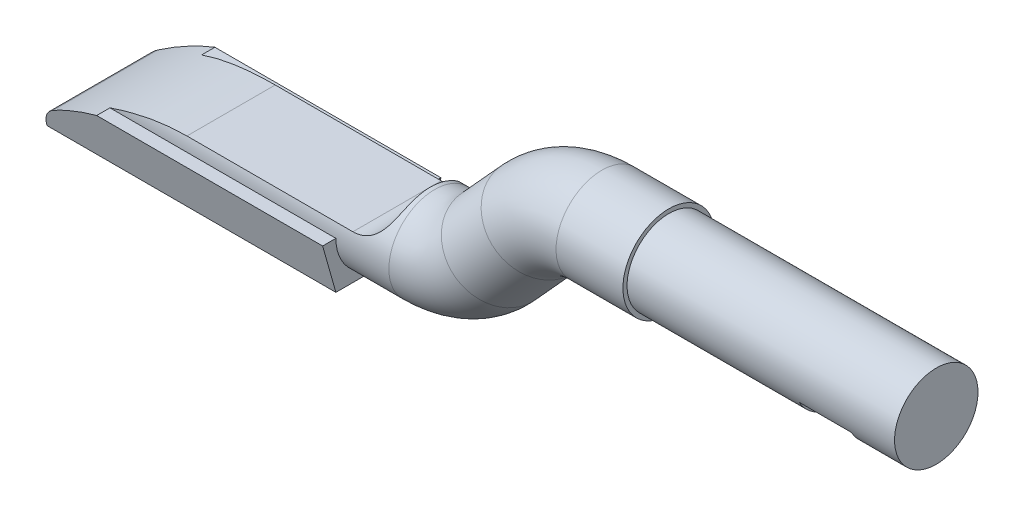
SolidWorks part; units mm, degrees
ref_plane "Front Plane" through (0, 0, 0) normal (0, 0, 1) x (1, 0, 0)
ref_plane "Top Plane" through (0, 0, 0) normal (0, 1, 0) x (1, 0, 0)
ref_plane "Right Plane" through (0, 0, 0) normal (1, 0, 0) x (0, 0, -1)
sketch "Sketch2" plane through (0, 0, 0) normal (0, 0, 1) x (1, 0, 0)
  line L0 (0, 13.9321) -> (0, -13.6478) construction
  line L1 (0, 0) -> (-80.0862, 0) construction
  line L2 (0, 0) -> (-31.75, 0)
  line L3 (-37.7989, -2.6801) -> (-41.5761, -6.8449)
  line L4 (-47.625, -9.525) -> (-80.0862, -9.525)
  arc A0 (-41.5761, -6.8449) -> (-47.625, -9.525) centre (-47.625, -1.3589) cw
  arc A1 (-31.75, 0) -> (-37.7989, -2.6801) centre (-31.75, -8.1661) ccw
  point P12 (-35.3682, 0)
  point P13 (-80.0862, 0)
  point P14 (0, 0)
  point P15 (0, 0)
  point P16 (0, 0)
  point P17 (-44.6575, -1.3589)
  point P18 (0, 0)
  dimension "D4" = 8.1661
  dimension "D1" = 9.525
  dimension "D2" = 31.75
  dimension "D3" = 47.625
  dimension "D5" = 80.0862
sketch "Sketch3" plane through (0, 0, 0) normal (1, 0, 0) x (0, 0, -1)
  circle A0 centre (0, 0) radius 4.3561
  dimension "D1" = 8.7122
sweep "Sweep1" add profiles "Sketch3" path "Sketch2"
sketch "Sketch4" plane through (0, 0, 0) normal (1, 0, 0) x (0, 0, -1)
  circle A0 centre (0, 0) radius 3.9624
  circle A1 centre (0, 0) radius 4.7625
  dimension "D1" = 7.9248
  dimension "D2" = 9.525
extrude "Cut-Extrude1" cut sketch "Sketch4" against normal blind 25.4
sketch "Sketch5" plane through (0, 0, 0) normal (0, 0, 1) x (1, 0, 0)
  line L0 (0, -3.9624) -> (0, 3.9624) construction
  line L1 (-9.525, -5.6896) -> (-4.572, -5.6896)
  line L2 (-9.525, -5.6896) -> (-9.525, -1.8796)
  line L3 (-9.525, -1.8796) -> (-4.572, -1.8796)
  line L4 (-4.572, -5.6896) -> (-4.572, -1.8796)
  line L5 (-9.525, -5.6896) -> (-4.572, -1.8796) construction
  line L6 (-9.525, -1.8796) -> (-4.572, -5.6896) construction
  line L7 (0, 3.9624) -> (-25.4, 3.9624) construction
  point P0 (-7.0485, -3.7846)
  dimension "D1" = 4.953
  dimension "D2" = 9.525
  dimension "D3" = 5.842
  dimension "D4" = 3.81
extrude "Cut-Extrude2" cut sketch "Sketch5" against normal through all both and the other way through all
sketch "Sketch6" plane through (-80.0862, 0, 0) normal (-1, 0, 0) x (0, 0, 1)
  line L0 (0, 0) -> (0, -13.8811) construction
  line L1 (4.3561, -13.97) -> (-4.3561, -13.97)
  line L2 (-4.3561, -13.97) -> (-5.6134, -9.525)
  line L3 (-5.6134, -9.525) -> (5.6134, -9.525)
  line L4 (4.3561, -13.97) -> (5.6134, -9.525)
  circle A0 centre (0, -9.525) radius 4.3561 construction
  point P11 (0, -13.97)
  point P12 (0, -9.525)
  dimension "D1" = 13.97
  dimension "D2" = 8.7122
  dimension "D3" = 11.2268
  dimension "D4" = 9.525
extrude "Boss-Extrude1" add sketch "Sketch6" against normal blind 27.432
sketch "Sketch7" plane through (0, 0, 0) normal (0, 0, 1) x (1, 0, 0)
  line L1 (-80.0862, -3.2639) -> (-48.0314, -3.2639)
  line L2 (-80.0862, -3.2639) -> (-80.0862, -8.3439)
  line L3 (-80.0862, -8.3439) -> (-51.2064, -8.3439)
  line L4 (-48.0314, -3.2639) -> (-48.0314, -5.1689)
  line L5 (-80.0862, -5.1689) -> (-80.0862, -9.525) construction
  line L6 (0, 0) -> (-80.0862, 0) construction
  line L7 (-47.625, -5.1689) -> (-80.0862, -5.1689) construction
  arc A0 (-51.2064, -8.3439) -> (-48.0314, -5.1689) centre (-51.2064, -5.1689) ccw
  point P10 (0, 0)
  dimension "D3" = 3.175
  dimension "D1" = 32.0548
  dimension "D2" = 3.175
  dimension "D4" = 5.08
extrude "Cut-Extrude3" cut sketch "Sketch7" against normal through all both and the other way through all
sketch "Sketch8" plane through (0, 0, 0) normal (0, 0, 1) x (1, 0, 0)
  line L0 (-52.6542, -13.97) -> (-80.0862, -13.97) construction
  line L1 (-51.2064, -8.3439) -> (-80.0862, -8.3439) construction
  line L2 (-80.0862, -13.97) -> (-80.0862, -8.3439)
  line L3 (-80.0862, -8.3439) -> (-66.9643, -8.3439)
  arc A0 (-80.0862, -13.97) -> (-78.9116, -11.8282) centre (-77.5462, -13.97) cw
  arc A1 (-66.9643, -8.3439) -> (-78.9116, -11.8282) centre (-66.9643, -30.5689) ccw
  dimension "D1" = 22.225
extrude "Cut-Extrude4" cut sketch "Sketch8" against normal through all both and the other way through all
